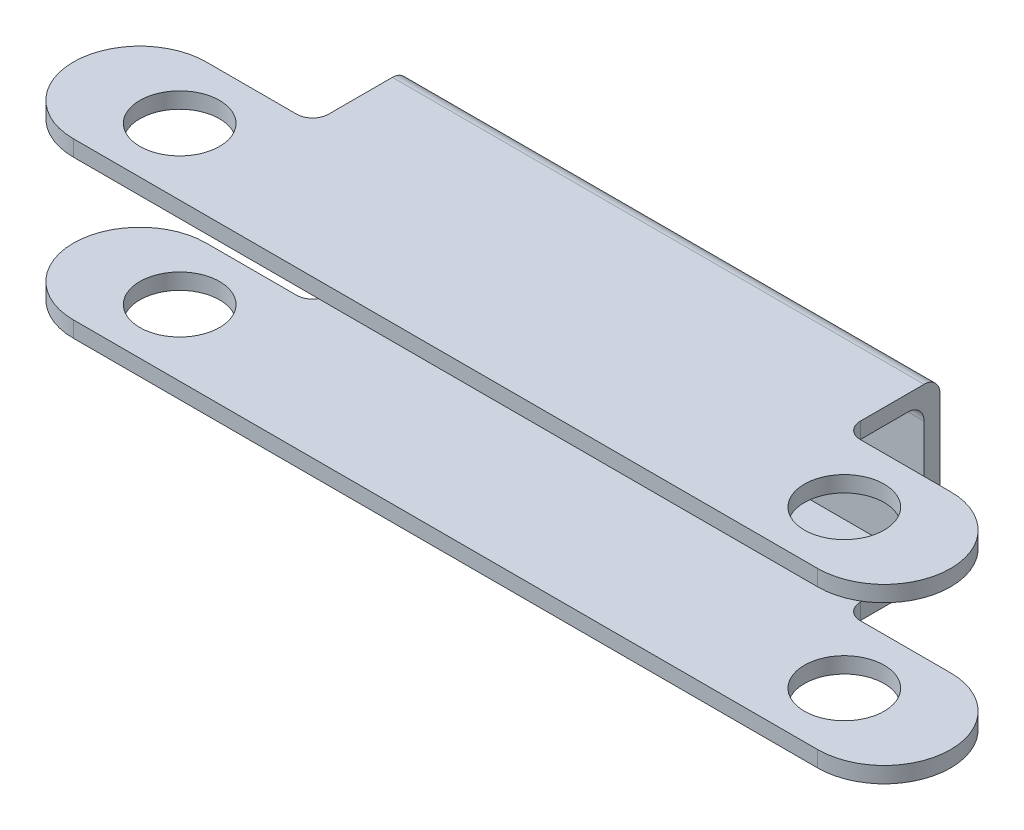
SolidWorks part; units mm, degrees
ref_plane "Vorne" through (0, 0, 0) normal (0, 0, 1) x (1, 0, 0)
ref_plane "Oben" through (0, 0, 0) normal (0, 1, 0) x (1, 0, 0)
ref_plane "Rechts" through (0, 0, 0) normal (1, 0, 0) x (0, 0, -1)
sketch "Skizze1" plane through (0, 0, 0) normal (0, 1, 0) x (1, 0, 0)
  line L0 (-140, 25) -> (-106, 25)
  line L1 (-100, 31) -> (-100, 55)
  line L2 (-100, 55) -> (100, 55)
  line L3 (100, 55) -> (100, 31)
  line L4 (106, 25) -> (140, 25)
  line L5 (-140, -25) -> (140, -25)
  line L6 (0, 0) -> (0, 25) construction
  circle A0 centre (-125, 0) radius 15
  circle A1 centre (125, 0) radius 15
  arc A2 (-106, 25) -> (-100, 31) centre (-106, 31) ccw
  arc A3 (140, -25) -> (140, 25) centre (140, 0) ccw
  arc A4 (-140, 25) -> (-140, -25) centre (-140, 0) ccw
  arc A5 (100, 31) -> (106, 25) centre (106, 31) ccw
  point P17 (-100, 25)
  point P20 (100, 25)
  dimension "D1" = 250
  dimension "D3" = 200
  dimension "D8" = 30
  dimension "D9" = 30
  dimension "D10" = 25
  dimension "D11" = 25
  dimension "D13" = 6
  dimension "D2" = 34
  dimension "D4" = 15
  dimension "D5" = 15
  dimension "D6" = 34
  dimension "D12" = 30
extrude "Linear austragen1" add sketch "Skizze1" along normal blind 6
ref_plane "Ebene3" through (0, 6, 0) normal (0, 1, 0) x (-1, 0, 0)
sketch "Skizze4" plane through (0, 6, 0) normal (0, 1, 0) x (-1, 0, 0)
  line L1 (100, -55) -> (-100, -55)
  line L2 (100, -55) -> (100, -61)
  line L3 (100, -61) -> (-100, -61)
  line L4 (-100, -55) -> (-100, -61)
  dimension "D1" = 6
extrude "Linear austragen2" add sketch "Skizze4" against normal blind 68
fillet "Verrundung1" radius 6 1 edges at (0, 6, -61)
fillet "Verrundung2" radius 6 1 edges
ref_plane "Ebene4" [suppressed] through (0, -26.5, 0) normal (0, -1, 0) x (1, 0, 0)
mirror "Spiegeln4" about plane through (0, -26.5, 0) normal (0, -1, 0) of "Linear austragen1"
